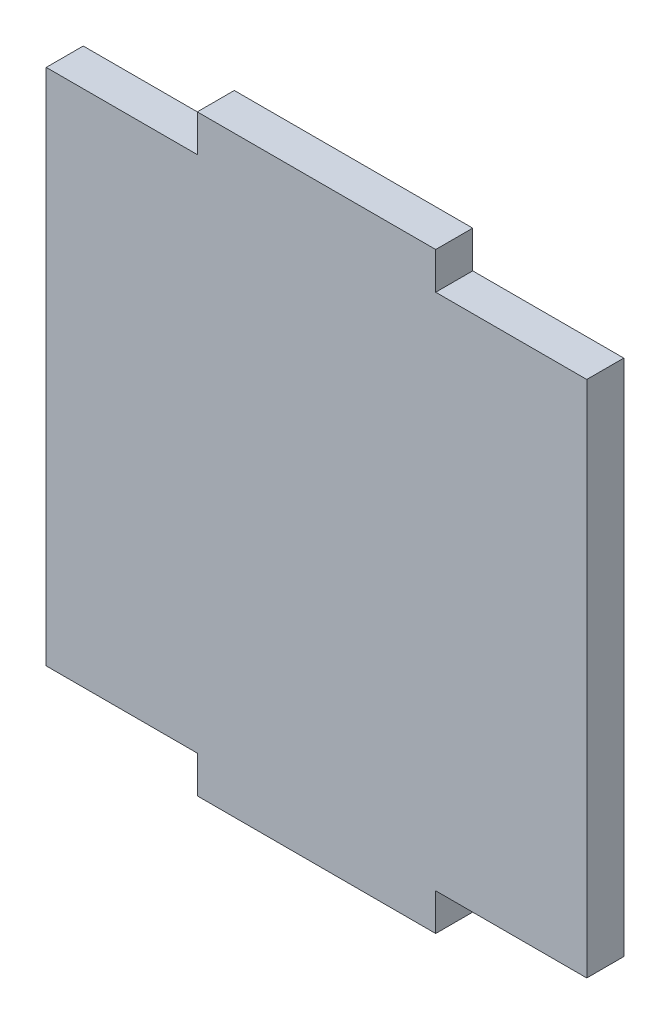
SolidWorks part; units mm, degrees
ref_plane "Front Plane" through (0, 0, 0) normal (0, 0, 1) x (1, 0, 0)
ref_plane "Top Plane" through (0, 0, 0) normal (0, 1, 0) x (1, 0, 0)
ref_plane "Right Plane" through (0, 0, 0) normal (1, 0, 0) x (0, 0, -1)
sketch "Sketch1" plane through (0, 0, 0) normal (0, 0, 1) x (1, 0, 0)
  line L1 (-8.0491, 0) -> (8.0491, 0)
  line L2 (-8.0491, 0) -> (-8.0491, -2.5)
  line L4 (8.0491, 0) -> (8.0491, -2.5)
  line L8 (-8.0491, -2.5) -> (-18.2491, -2.5)
  line L9 (18.2491, -2.5) -> (8.0491, -2.5)
  line L10 (18.2491, -2.5) -> (18.2491, -37.5)
  line L11 (18.2491, -37.5) -> (8.0491, -37.5)
  line L12 (-18.2491, -2.5) -> (-18.2491, -37.5)
  line L14 (-8.0491, -37.5) -> (-8.0491, -40)
  line L15 (-8.0491, -40) -> (8.0491, -40)
  line L16 (8.0491, -37.5) -> (8.0491, -40)
  line L17 (-8.0491, -37.5) -> (-18.2491, -37.5)
  dimension "D1" = 8.0491
  dimension "D2" = 18.2491
  dimension "D3" = 8.0491
  dimension "D4" = 2.5
  dimension "D5" = 37.5
extrude "Boss-Extrude1" add sketch "Sketch1" along normal blind 2.5 contours L10 L11 L16 L15 L14 L17 L12 L8 L2 L1 L4 L9
